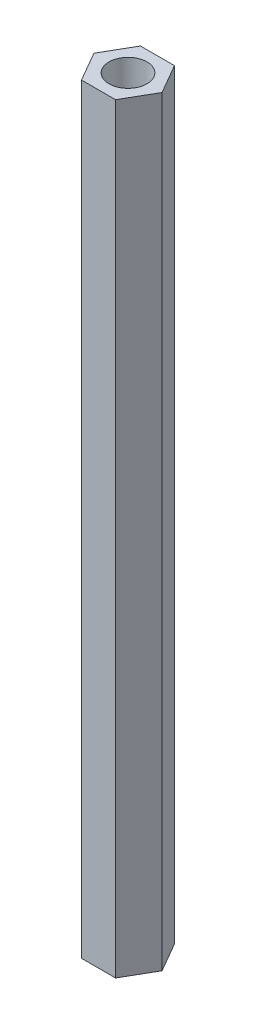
SolidWorks part; units mm, degrees
ref_plane "前视基准面" through (0, 0, 0) normal (0, 0, 1) x (1, 0, 0)
ref_plane "上视基准面" through (0, 0, 0) normal (0, 1, 0) x (1, 0, 0)
ref_plane "右视基准面" through (0, 0, 0) normal (1, 0, 0) x (0, 0, -1)
other "Configuration Table"
sketch "草图1" plane through (0, 0, 0) normal (0, 1, 0) x (1, 0, 0)
  line L1 (3.5796, 0) -> (1.7898, 3.1)
  line L2 (1.7898, 3.1) -> (-1.7898, 3.1)
  line L3 (-1.7898, 3.1) -> (-3.5796, 0)
  line L4 (-3.5796, 0) -> (-1.7898, -3.1)
  line L5 (-1.7898, -3.1) -> (1.7898, -3.1)
  line L6 (1.7898, -3.1) -> (3.5796, 0)
  circle A0 centre (0, 0) radius 3.1 construction
  circle A1 centre (0, 0) radius 2
  dimension "D2" = 4
  dimension "D1" = 6.2
extrude "凸台-拉伸1" add sketch "草图1" along normal blind 80
